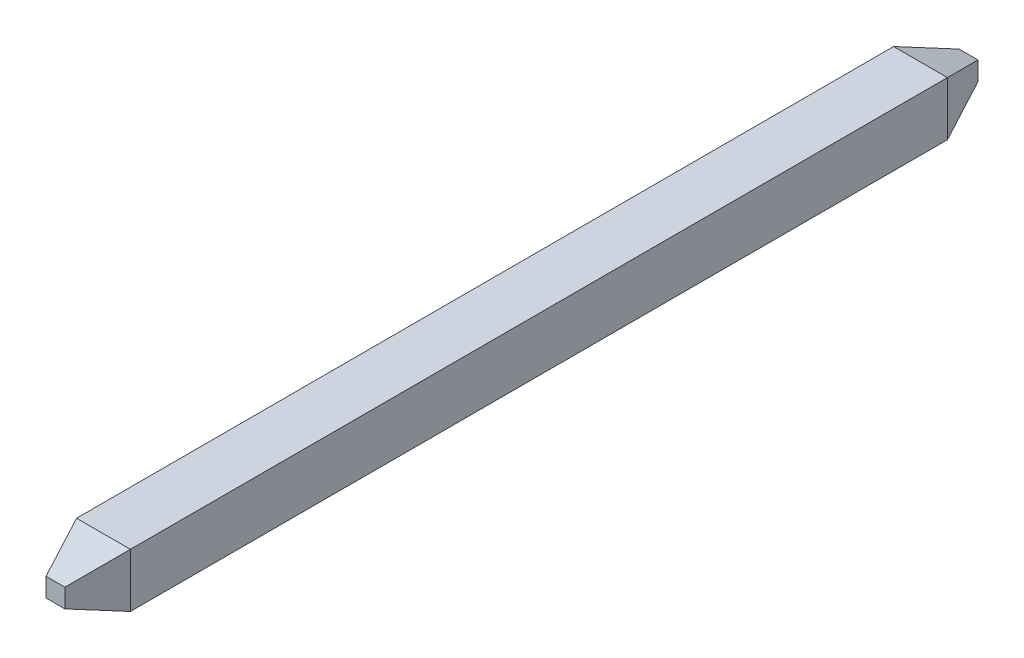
SolidWorks part; units mm, degrees
ref_plane "Plan de face" through (0, 0, 0) normal (0, 0, 1) x (1, 0, 0)
ref_plane "Plan de dessus" through (0, 0, 0) normal (0, 1, 0) x (1, 0, 0)
ref_plane "Plan de droite" through (0, 0, 0) normal (1, 0, 0) x (0, 0, -1)
sketch "Esquisse1" plane through (0, 0, 0) normal (0, 0, 1) x (1, 0, 0)
  line L0 (0, 0) -> (0.9256, 0) construction
  line L1 (0.56, -0.56) -> (0.56, 0.56)
  line L2 (0.56, 0.56) -> (-0.56, 0.56)
  line L3 (-0.56, 0.56) -> (-0.56, -0.56)
  line L4 (-0.56, -0.56) -> (0.56, -0.56)
  circle A0 centre (0, 0) radius 0.56 construction
  dimension "D1" = 1.12
  dimension "D2" = 90
extrude "Extrusion1" add sketch "Esquisse1" along normal blind 17
sketch "Esquisse2" plane through (0, 0, 17) normal (0, 0, 1) x (1, 0, 0)
  line L1 (0.56, 0.56) -> (-0.56, 0.56)
  line L2 (-0.56, 0.56) -> (-0.56, -0.56)
  line L3 (-0.56, -0.56) -> (0.56, -0.56)
  line L4 (0.56, -0.56) -> (0.56, 0.56)
  circle A0 centre (0, 0) radius 0.56 construction
extrude "Extrusion2" add sketch "Esquisse2" along normal blind 1 draft 20
sketch "Esquisse3" plane through (0, 0, 0) normal (0, 0, -1) x (-1, 0, 0)
  line L1 (0.56, -0.56) -> (0.56, 0.56)
  line L2 (0.56, 0.56) -> (-0.56, 0.56)
  line L3 (-0.56, 0.56) -> (-0.56, -0.56)
  line L4 (-0.56, -0.56) -> (0.56, -0.56)
  circle A0 centre (0, 0) radius 0.56 construction
extrude "Extrusion3" add sketch "Esquisse3" along normal blind 1 draft 20
